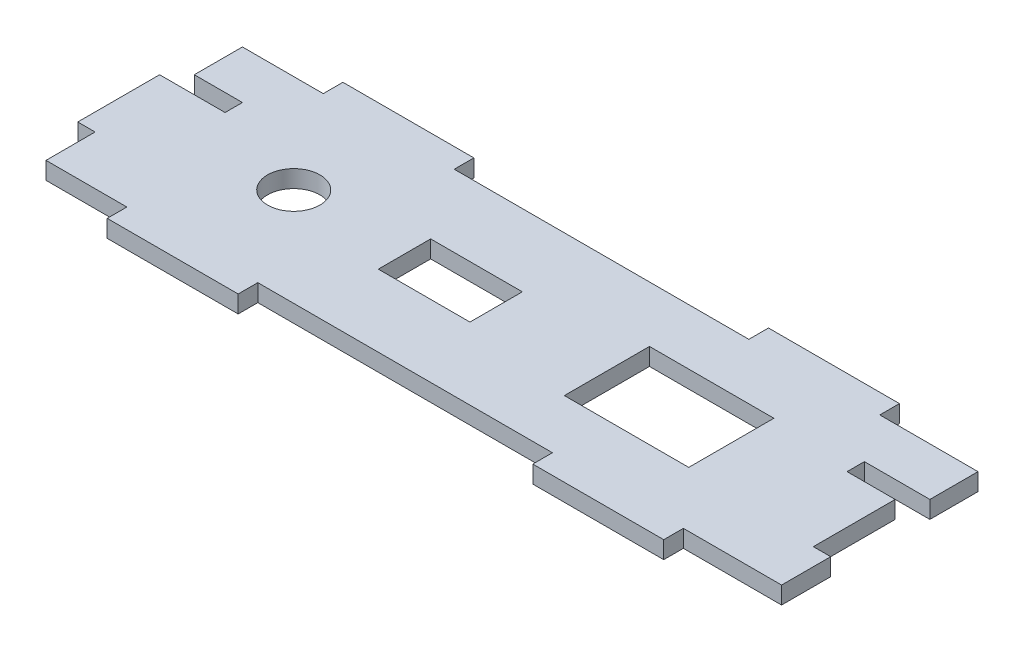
SolidWorks part; units mm, degrees
ref_plane "Alzado" through (0, 0, 0) normal (0, 0, 1) x (1, 0, 0)
ref_plane "Planta" through (0, 0, 0) normal (0, 1, 0) x (1, 0, 0)
ref_plane "Vista lateral" through (0, 0, 0) normal (1, 0, 0) x (0, 0, -1)
sketch "Croquis1" plane through (0, 0, 0) normal (0, 0, 1) x (1, 0, 0)
  line L0 (110, 125) -> (98.2578, 125) construction
  line L2 (0, 240) -> (0, 10) construction
  line L5 (5, 120) -> (120, 120)
  line L6 (5, 120) -> (5, 117.35)
  line L8 (120, 120) -> (120, 117.35)
  line L9 (5, 117.35) -> (120, 117.35)
  dimension "D1" = 115
  dimension "D2" = 5
  dimension "D3" = 5
  dimension "D4" = 2.65
extrude "Saliente-Extruir1" add sketch "Croquis1" along normal blind 30
sketch "Croquis2" plane through (0, 0, 0) normal (0, 0, -1) x (-1, 0, 0)
  line L0 (-120, 120) -> (-5, 120) construction
  line L1 (-20, 120) -> (-40, 120)
  line L2 (-20, 120) -> (-20, 117.35)
  line L3 (-20, 117.35) -> (-40, 117.35)
  line L4 (-40, 120) -> (-40, 117.35)
  line L5 (-5, 117.35) -> (-120, 117.35) construction
  line L6 (-62.5, 120) -> (-62.5, 131.5364) construction
  line L8 (-5, 105) -> (-5, 120) construction
  line L9 (-5, 120) -> (-20, 120) construction
  line L10 (-7.5, 105) -> (-7.5, 85) construction
  line L11 (-85, 120) -> (-85, 117.35)
  line L12 (-105, 117.35) -> (-85, 117.35)
  line L13 (-105, 120) -> (-105, 117.35)
  line L14 (-105, 120) -> (-85, 120)
extrude "Saliente-Extruir2" add sketch "Croquis2" along normal blind 3
sketch "Croquis3" plane through (0, 120, 0) normal (0, 1, 0) x (1, 0, 0)
  line L0 (120, -30) -> (120, 0) construction
  line L1 (120, -7.5) -> (117.35, -7.5)
  line L2 (120, -7.5) -> (120, -22.5)
  line L3 (120, -22.5) -> (117.35, -22.5)
  line L4 (117.35, -7.5) -> (117.35, -22.5)
  line L5 (120, -30) -> (5, -30) construction
  line L6 (120, -22.5) -> (5, -22.5) construction
  line L7 (5, -30) -> (5, 0) construction
  line L8 (120, -7.5) -> (5, -7.5) construction
  line L9 (7.65, -30) -> (7.65, -22.5)
  line L10 (7.65, -22.5) -> (5, -22.5)
  line L11 (5, -22.5) -> (5, -7.5) construction
  line L12 (5, -7.5) -> (7.65, -7.5)
  line L13 (7.65, -7.5) -> (7.65, 0)
  line L14 (20, 0) -> (5, 0) construction
  line L15 (7.65, -30) -> (5, -30)
  line L16 (5, -30) -> (5, -22.5)
  line L17 (5, -7.5) -> (5, 0)
  line L18 (5, 0) -> (7.65, 0)
  dimension "D1" = 15
  dimension "D2" = 7.5
  dimension "D3" = 2.65
extrude "Cortar-Extruir1" cut sketch "Croquis3" against normal up to surface (2.65 mm away)
ref_plane "Plano1" through (0, 0, 15) normal (0, 0, 1) x (1, 0, 0)
mirror "Simetría1" about plane through (0, 0, 15) normal (0, 0, 1) of "Saliente-Extruir2"
sketch "Croquis4" plane through (0, 120, 0) normal (0, 1, 0) x (1, 0, 0)
  line L0 (7.65, -22.5) -> (5, -22.5) construction
  line L1 (5, -7.35) -> (15, -7.35)
  line L2 (5, -7.35) -> (5, -10)
  line L3 (5, -10) -> (15, -10)
  line L4 (15, -7.35) -> (15, -10)
  line L5 (62.5, 0) -> (62.5, -19.6971) construction
  line L6 (85, 0) -> (40, 0) construction
  line L7 (110, -7.35) -> (110, -10)
  line L8 (120, -10) -> (110, -10)
  line L9 (120, -7.35) -> (120, -10)
  line L10 (120, -7.35) -> (110, -7.35)
  line L11 (20, 0) -> (7.65, 0) construction
  dimension "D1" = 10
  dimension "D2" = 10
extrude "Cortar-Extruir2" cut sketch "Croquis4" against normal blind 3
sketch "Croquis5" plane through (0, 120, 0) normal (0, 1, 0) x (1, 0, 0)
  line L0 (97.35, -15.0285) -> (117.35, -15.0285) construction
  line L1 (78.35, -8.5285) -> (97.35, -8.5285)
  line L2 (78.35, -8.5285) -> (78.35, -21.5285)
  line L3 (78.35, -21.5285) -> (97.35, -21.5285)
  line L4 (97.35, -8.5285) -> (97.35, -21.5285)
  line L5 (117.35, -10) -> (117.35, -22.5) construction
  dimension "D1" = 19
  dimension "D2" = 13
  dimension "D3" = 20
extrude "Cortar-Extruir3" cut sketch "Croquis5" against normal up to surface (2.65 mm away)
sketch "Croquis6" plane through (0, 120, 0) normal (0, 1, 0) x (1, 0, 0)
  line L0 (30.973, -33) -> (30, 3) construction
  line L1 (20, -33) -> (40, -33) construction
  line L2 (20, 3) -> (40, 3) construction
  circle A0 centre (30.4865, -15) radius 4
  dimension "D1" = 8
extrude "Cortar-Extruir4" cut sketch "Croquis6" against normal up to next
sketch "Croquis7" plane through (0, 120, 0) normal (0, 1, 0) x (1, 0, 0)
  line L0 (30.4865, -15) -> (78.35, -15.0285) construction
  line L1 (78.35, -8.5285) -> (78.35, -21.5285) construction
  line L3 (61.4183, -19.0143) -> (47.4183, -19.0143)
  line L4 (61.4183, -19.0143) -> (61.4183, -11.0143)
  line L5 (61.4183, -11.0143) -> (47.4183, -11.0143)
  line L6 (47.4183, -19.0143) -> (47.4183, -11.0143)
  line L7 (61.4183, -19.0143) -> (47.4183, -11.0143) construction
  line L8 (61.4183, -11.0143) -> (47.4183, -19.0143) construction
  point P5 (54.4183, -15.0143)
  dimension "D1" = 14
  dimension "D2" = 8
extrude "Cortar-Extruir5" cut sketch "Croquis7" against normal up to next
